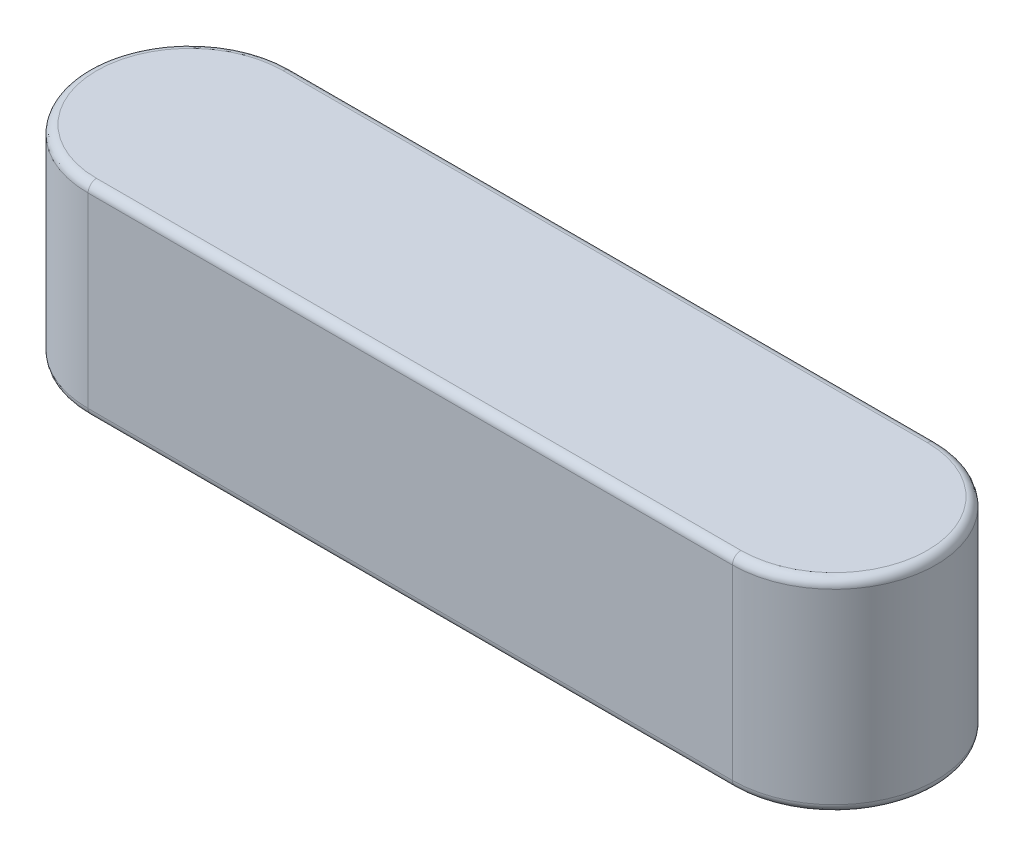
SolidWorks part; units mm, degrees
ref_plane "Front Plane" through (0, 0, 0) normal (0, 0, 1) x (1, 0, 0)
ref_plane "Top Plane" through (0, 0, 0) normal (0, 1, 0) x (1, 0, 0)
ref_plane "Right Plane" through (0, 0, 0) normal (1, 0, 0) x (0, 0, -1)
other "Configuration Table"
sketch "Sketch1" plane through (0, 0, 0) normal (0, 1, 0) x (1, 0, 0)
  line L1 (-19, 3) -> (0, 3)
  line L3 (-19, -3) -> (0, -3)
  arc A0 (0, -3) -> (0, 3) centre (0, 0) ccw
  arc A1 (-19, 3) -> (-19, -3) centre (-19, 0) ccw
  dimension "l" = 25
  dimension "b" = 6
extrude "Extrude1" add sketch "Sketch1" along normal blind 6
fillet "Fillet1" radius 0.25 8 edges at (-9.5, 0, -3) (3, 0, 0) (-22, 0, 0) (-9.5, 0, 3) (3, 6, 0) (-9.5, 6, 3) (-9.5, 6, -3) (-22, 6, 0)
